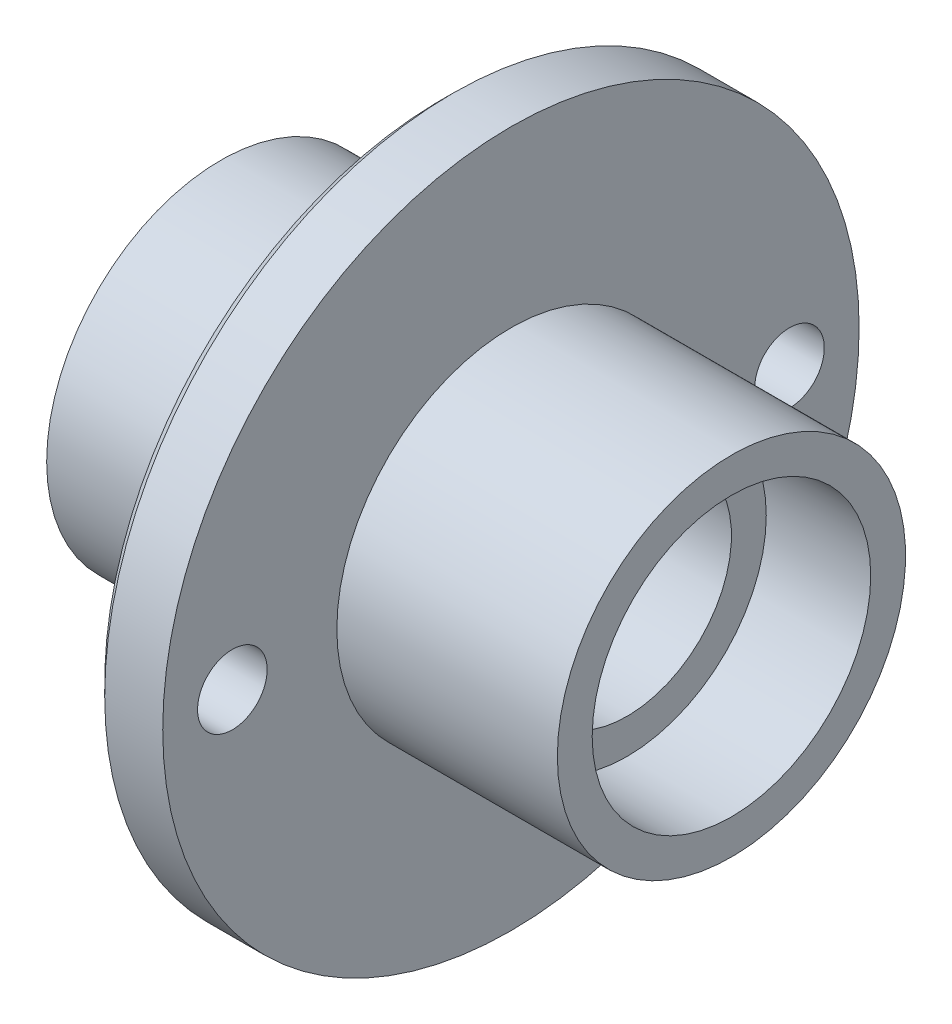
SolidWorks part; units mm, degrees
ref_plane "Front" through (0, 0, 0) normal (0, 0, 1) x (1, 0, 0)
ref_plane "Top" through (0, 0, 0) normal (0, 1, 0) x (1, 0, 0)
ref_plane "Right" through (0, 0, 0) normal (1, 0, 0) x (0, 0, -1)
sketch "Esquisse1" plane through (0, 0, 0) normal (0, 0, 1) x (1, 0, 0)
  line L0 (-1.5, 15) -> (1.5, 15)
  line L1 (0, -50) -> (0, 50) construction
  line L2 (1.5, 15) -> (1.5, 7.5)
  line L3 (1.5, 7.5) -> (11, 7.5)
  line L4 (11, 7.5) -> (11, 6)
  line L5 (11, 6) -> (6.5, 6)
  line L6 (6.5, 6) -> (6.5, 4.5)
  line L7 (6.5, 4.5) -> (-6.5, 4.5)
  line L8 (0, 40.8202) -> (0, -29.4721) construction
  line L9 (-41.5363, 0) -> (28.6457, 0) construction
  line L10 (50, 0) -> (-50, 0) construction
  line L11 (-6.5, 6) -> (-6.5, 4.5)
  line L12 (-11, 6) -> (-6.5, 6)
  line L13 (-11, 7.5) -> (-11, 6)
  line L14 (-1.5, 7.5) -> (-11, 7.5)
  line L15 (-1.5, 15) -> (-1.5, 7.5)
  point P18 (0, 4.5)
  point P23 (0, 15)
  dimension "D1" = 9
  dimension "D2" = 12
  dimension "D3" = 15
  dimension "D4" = 30
  dimension "D5" = 3
  dimension "D6" = 22
  dimension "D7" = 4.5
revolve "Révolution1" add sketch "Esquisse1" angle 360 about L9
chamfer "Chanfrein1" distance 0.5 angle 45 1 edges at (-1.5, 0, 15)
hole_wizard "Diamètre du perçage Ø0.15 (0.15)1" positions "Esquisse3" profile "Esquisse2" hole size "Ø0.15" standard "Ansi Metric"
sketch "Esquisse3" plane through (-1.5, 0, 0) normal (-1, 0, 0) x (0, 0, 1)
  point P0 (12, 0)
  dimension "D1" = 12
sketch "Esquisse2" plane through (-1.5, 0, 12) normal (0, 1, 0) x (0, 0, 1)
  line L0 (0, 0) -> (0, 3.001)
  line L1 (0, 3.001) -> (1.5, 3.001)
  line L2 (1.5, 3.001) -> (1.5, 0)
  line L5 (1.5, 0) -> (0, 0)
  line L11 (0, -6.35) -> (0, 107.95) construction
  dimension "Diamètre du perçage jusqu'au prochain" = 3
  dimension "Profondeur du perçage jusqu'au prochain" = 3.001
pattern_circular "Répétition circulaire1" count 2 over 360 about axis through (0, 0, 0) along (1, 0, 0) of "Diamètre du perçage Ø0.15 (0.15)1"
